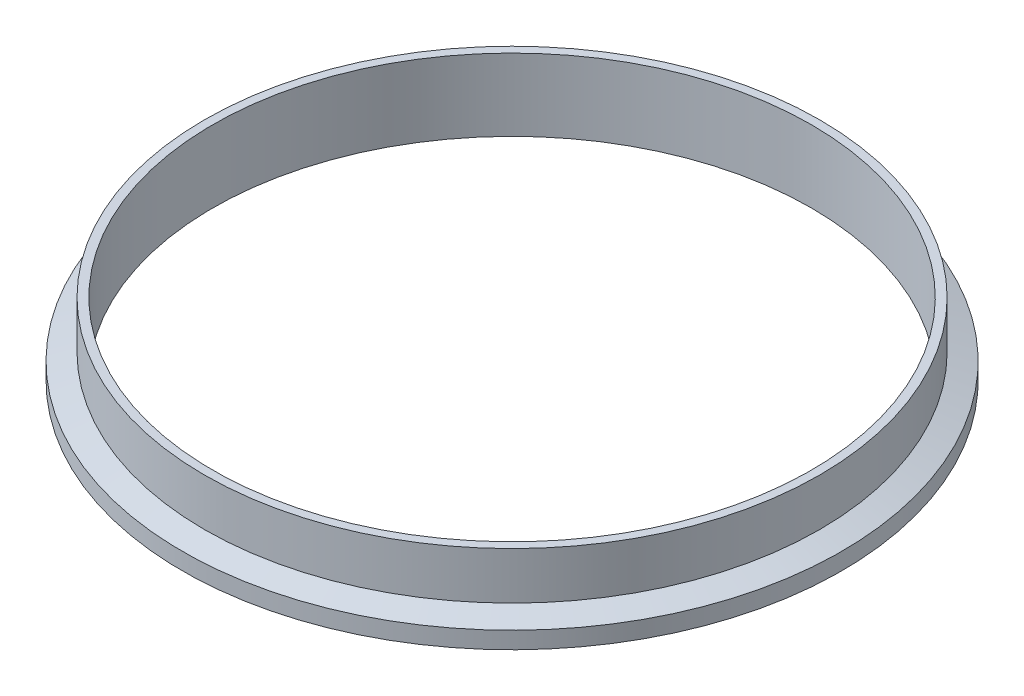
SolidWorks part; units mm, degrees
ref_plane "Front Plane" through (0, 0, 0) normal (0, 0, 1) x (1, 0, 0)
ref_plane "Top Plane" through (0, 0, 0) normal (0, 1, 0) x (1, 0, 0)
ref_plane "Right Plane" through (0, 0, 0) normal (1, 0, 0) x (0, 0, -1)
sketch "Sketch1" plane through (0, 0, 0) normal (0, 0, 1) x (1, 0, 0)
  line L0 (0, 0) -> (0, 23.8252) construction
  line L1 (0, 23.8252) -> (-101.6, 23.8252)
  line L2 (-101.6, 23.8252) -> (-101.6, 8.2228)
  line L3 (-101.6, 8.2228) -> (-108.839, 5.588)
  line L4 (-108.839, 5.588) -> (-108.839, 0)
  line L5 (-108.839, 0) -> (-105.3992, 0)
  line L6 (-101.7632, 0) -> (0, 0)
  line L7 (0, 0) -> (0, 23.8252)
  line L8 (0, 23.8252) -> (-98.8314, 23.8252)
  line L9 (-98.8314, 23.8252) -> (-98.8314, 0)
  line L10 (-98.8314, 0) -> (0, 0)
  line L11 (0, 0) -> (-0.1846, 0.0129)
  arc A0 (-104.6767, 0.4745) -> (-102.4857, 0.4745) centre (-103.5812, 0) cw
  arc A1 (-101.7632, 0) -> (-102.4857, 0.4745) centre (-101.7632, 0.7874) cw
  arc A2 (-104.6767, 0.4745) -> (-105.3992, 0) centre (-105.3992, 0.7874) cw
  point P12 (-102.3874, 0)
  dimension "D6" = 1.1938
  dimension "D7" = 0.7874
  dimension "D1" = 101.6
  dimension "D2" = 5.588
  dimension "D3" = 108.839
  dimension "D4" = 70
  dimension "D5" = 103.5812
  dimension "D8" = 2.7686
  dimension "D9" = 23.8252
revolve "Revolve2" add sketch "Sketch1" angle 360 about L0
